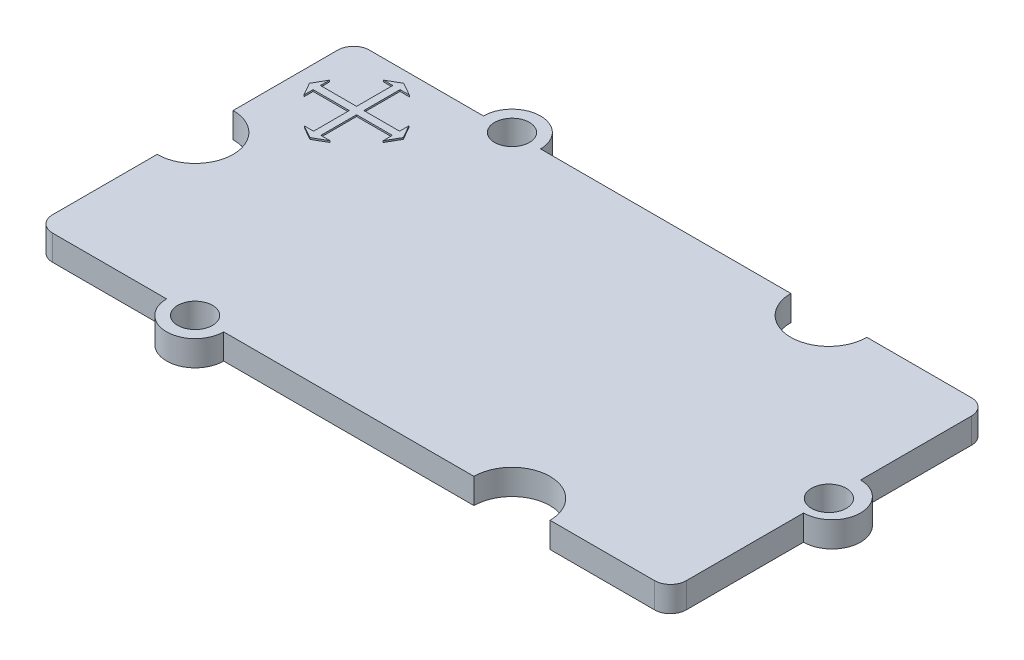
SolidWorks part; units mm, degrees
ref_plane "Plan de face" through (0, 0, 0) normal (0, 0, 1) x (1, 0, 0)
ref_plane "Plan de dessus" through (0, 0, 0) normal (0, 1, 0) x (1, 0, 0)
ref_plane "Plan de droite" through (0, 0, 0) normal (1, 0, 0) x (0, 0, -1)
sketch "Esquisse1" plane through (0, 0, 0) normal (0, -1, 0) x (1, 0, 0)
  line L13 (-39.6997, 0) -> (-55.4997, 0)
  line L14 (-59.0997, 20) -> (-66.2997, 20)
  line L15 (-27.2997, 8) -> (-27.2997, 1)
  line L16 (-59.0997, 0) -> (-66.2997, 0)
  line L17 (-34.8997, 0) -> (-28.2997, 0)
  line L18 (-34.8997, 20) -> (-28.2997, 20)
  line L19 (-67.2997, 7.6) -> (-67.2997, 1)
  line L20 (-39.6997, 20) -> (-55.4997, 20)
  line L21 (-27.2997, 19) -> (-27.2997, 11.6)
  line L22 (-67.2997, 19) -> (-67.2997, 12.4)
  arc A13 (-28.2997, 0) -> (-27.2997, 1) centre (-28.2997, 1) ccw
  arc A14 (-28.2997, 20) -> (-27.2997, 19) centre (-28.2997, 19) cw
  arc A15 (-67.2997, 19) -> (-66.2997, 20) centre (-66.2997, 19) cw
  arc A16 (-67.2997, 1) -> (-66.2997, 0) centre (-66.2997, 1) ccw
  circle A17 centre (-57.2997, 0) radius 1.1
  arc A18 (-55.4997, 20) -> (-59.0997, 20) centre (-57.2997, 20) ccw
  arc A19 (-55.4997, 0) -> (-59.0997, 0) centre (-57.2997, 0) cw
  arc A20 (-27.2997, 11.6) -> (-27.2997, 8) centre (-27.2997, 9.8) cw
  circle A21 centre (-57.2997, 20) radius 1.1
  circle A22 centre (-27.2997, 10) radius 1.1
  arc A23 (-39.6997, 20) -> (-34.8997, 20) centre (-37.2997, 20) ccw
  arc A24 (-67.2997, 7.6) -> (-67.2997, 12.4) centre (-67.2997, 10) ccw
  arc A25 (-39.6997, 0) -> (-34.8997, 0) centre (-37.2997, 0) cw
extrude "Extrusion1" add sketch "Esquisse1" along normal blind 1.6
sketch "Esquisse2" plane through (0, 0, 0) normal (0, 1, 0) x (-1, 0, 0)
  line L0 (63.2997, 0.8305) -> (62.4877, 1.2945)
  line L1 (63.5288, 3.7945) -> (64.3805, 3.7945) construction
  line L2 (63.0723, 4.0375) -> (63.0723, 6.2945)
  line L3 (67.2997, 7.6) -> (67.2997, 1) construction
  line L4 (63.5288, 1.2945) -> (63.5288, 3.581)
  line L5 (64.1117, 1.2945) -> (63.5288, 1.2945)
  line L6 (63.2997, 0.8305) -> (63.2997, 3.8084) construction
  line L7 (63.2997, 0.8305) -> (64.1117, 1.2945)
  line L8 (62.4877, 1.2945) -> (63.0723, 1.2945)
  line L9 (62.4877, 6.2945) -> (63.0723, 6.2945)
  line L10 (63.2997, 6.7586) -> (64.1117, 6.2945)
  line L11 (64.1117, 6.2945) -> (63.5288, 6.2945)
  line L12 (63.2997, 6.7586) -> (62.4877, 6.2945)
  line L13 (66.2776, 3.8084) -> (65.8136, 2.9964)
  line L14 (65.8136, 3.581) -> (63.5288, 3.581)
  line L15 (65.8136, 4.0375) -> (63.5288, 4.0375)
  line L16 (65.8136, 4.6204) -> (65.8136, 4.0375)
  line L17 (66.2776, 3.8084) -> (65.8136, 4.6204)
  line L18 (65.8136, 2.9964) -> (65.8136, 3.581)
  line L19 (60.8136, 2.9964) -> (60.8136, 3.581)
  line L20 (60.3495, 3.8084) -> (60.8136, 4.6204)
  line L21 (60.8136, 4.6204) -> (60.8136, 4.0375)
  line L22 (60.3495, 3.8084) -> (60.8136, 2.9964)
  line L23 (63.3136, 4.0375) -> (63.3136, 4.8891) construction
  line L24 (66.2776, 3.8084) -> (63.2997, 3.8084) construction
  line L25 (60.8136, 3.581) -> (63.0723, 3.581)
  line L26 (60.8136, 4.0375) -> (63.0723, 4.0375)
  line L27 (63.5288, 4.0375) -> (63.5288, 6.2945)
  line L28 (63.0723, 3.581) -> (63.0723, 1.2945)
  line L30 (63.5288, 1.2945) -> (63.5288, 4.0375)
  point P9 (63.2997, 1.2945)
  point P11 (63.2997, 6.2945)
  point P28 (60.8136, 3.8084)
  point P30 (65.8136, 3.8084)
  dimension "D1" = 5
  dimension "D2" = 4
extrude "Extrusion2" add sketch "Esquisse2" along normal blind 0.1
